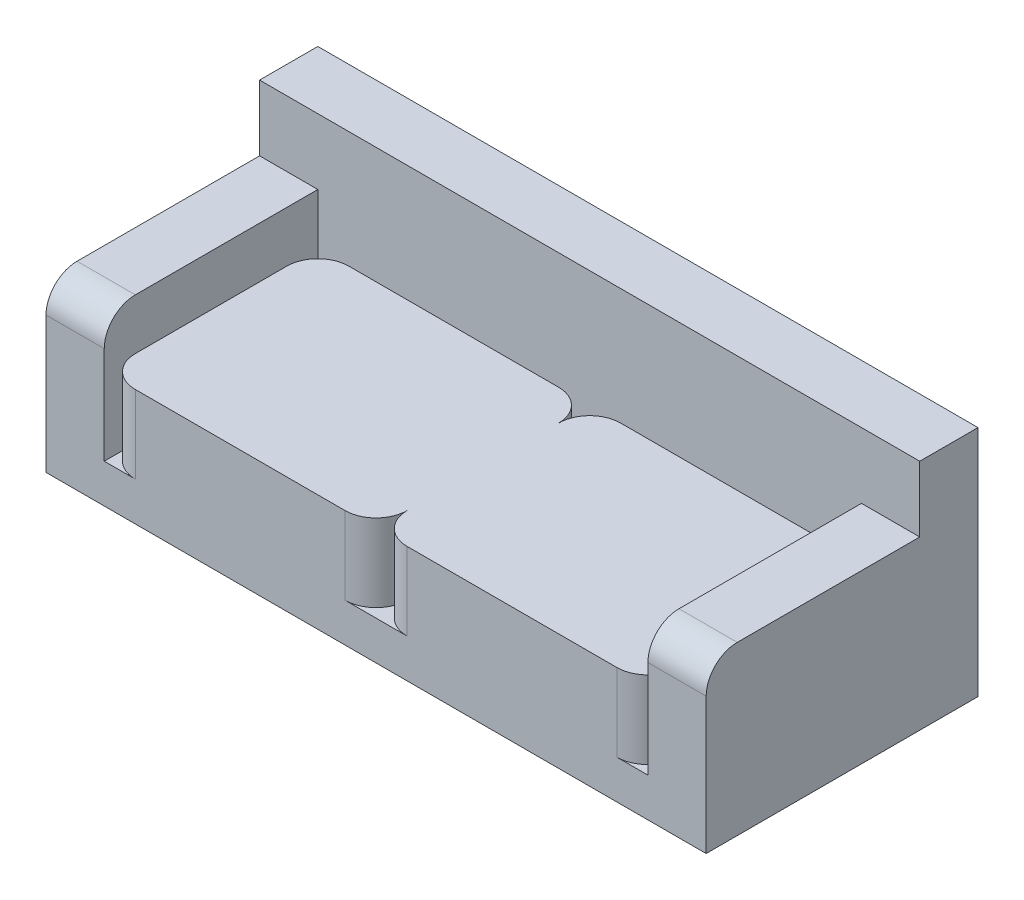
SolidWorks part; units mm, degrees
ref_plane "Plan de face" through (0, 0, 0) normal (0, 0, 1) x (1, 0, 0)
ref_plane "Plan de dessus" through (0, 0, 0) normal (0, 1, 0) x (1, 0, 0)
ref_plane "Plan de droite" through (0, 0, 0) normal (1, 0, 0) x (0, 0, -1)
sketch "Esquisse1" plane through (0, 0, 0) normal (0, 1, 0) x (1, 0, 0)
  line L1 (-350, 275) -> (350, 275)
  line L2 (-350, 275) -> (-350, -275)
  line L3 (-350, -275) -> (350, -275)
  line L4 (350, 275) -> (350, -275)
  line L5 (-350, 275) -> (350, -275) construction
  line L6 (-350, -275) -> (350, 275) construction
  point P0 (0, 0)
  dimension "D1" = 700
  dimension "D2" = 550
extrude "Boss.-Extru.1" add sketch "Esquisse1" along normal blind 200
fillet "Congé1" radius 80 4 edges at (-350, 100, 275) (-350, 100, -275) (350, 100, -275) (350, 100, 275)
pattern_linear "Répétition linéaire3" count 2 spacing 700 along (1, 0, 0) of "Boss.-Extru.1", "Congé1"
sketch "Esquisse2" plane through (0, 0, 0) normal (0, -1, 0) x (1, 0, 0)
  line L0 (-270, 275) -> (270, 275) construction
  line L1 (1200, 275) -> (-500, 275)
  line L2 (1200, 275) -> (1200, -275)
  line L3 (1200, -275) -> (-500, -275)
  line L4 (-500, 275) -> (-500, -275)
  line L5 (1200, 275) -> (-500, -275) construction
  line L6 (1200, -275) -> (-500, 275) construction
  line L7 (270, -275) -> (-270, -275) construction
  line L8 (-350, -195) -> (-350, 195) construction
  line L9 (1050, 195) -> (1050, -195) construction
  point P0 (350, 0)
  dimension "D1" = 150
  dimension "D2" = 150
extrude "Boss.-Extru.2" add sketch "Esquisse2" along normal blind 100
sketch "Esquisse3" plane through (0, 0, 0) normal (0, 1, 0) x (1, 0, 0)
  line L1 (1200, 275) -> (1050, 275)
  line L2 (1200, 275) -> (1200, -275)
  line L3 (1200, -275) -> (1050, -275)
  line L4 (1050, 275) -> (1050, -275)
  line L5 (-270, -275) -> (-500, -275) construction
  line L6 (-500, 275) -> (-350, 275)
  line L7 (-500, 275) -> (-500, -275)
  line L8 (-500, -275) -> (-350, -275)
  line L9 (-350, 275) -> (-350, -275)
  line L10 (-350, 195) -> (-350, -195) construction
  line L12 (1200, -275) -> (970, -275) construction
  line L13 (1050, -195) -> (1050, 195) construction
extrude "Boss.-Extru.3" add sketch "Esquisse3" along normal blind 331
fillet "Congé2" radius 80 2 edges at (1125, 331, 275) (-425, 331, 275)
sketch "Esquisse4" plane through (0, 0, -275) normal (0, 0, -1) x (-1, 0, 0)
  line L1 (500, -100) -> (-1200, -100)
  line L2 (500, -100) -> (500, 500)
  line L3 (500, 500) -> (-1200, 500)
  line L4 (-1200, -100) -> (-1200, 500)
  dimension "D1" = 600
extrude "Boss.-Extru.4" add sketch "Esquisse4" along normal blind 150
sketch "Esquisse5" plane through (0, -100, 0) normal (0, -1, 0) x (1, 0, 0)
  line L0 (1200, 275) -> (-500, 275) construction
  line L1 (-500, 275) -> (-500, -425) construction
  line L2 (1200, -425) -> (-500, -425) construction
  line L3 (1200, -425) -> (1200, 275) construction
  circle A0 centre (-400, 175) radius 50
  circle A1 centre (1100, 175) radius 50
  circle A2 centre (1100, -325) radius 50
  circle A3 centre (-400, -325) radius 50
  dimension "D1" = 100
  dimension "D3" = 100
  dimension "D4" = 100
  dimension "D5" = 100
  dimension "D6" = 100
  dimension "D8" = 100
  dimension "D9" = 100
  dimension "D10" = 100
  dimension "D11" = 100
  dimension "D12" = 100
  dimension "D2" = 100
  dimension "D7" = 100
extrude "Boss.-Extru.5" add sketch "Esquisse5" along normal blind 50
